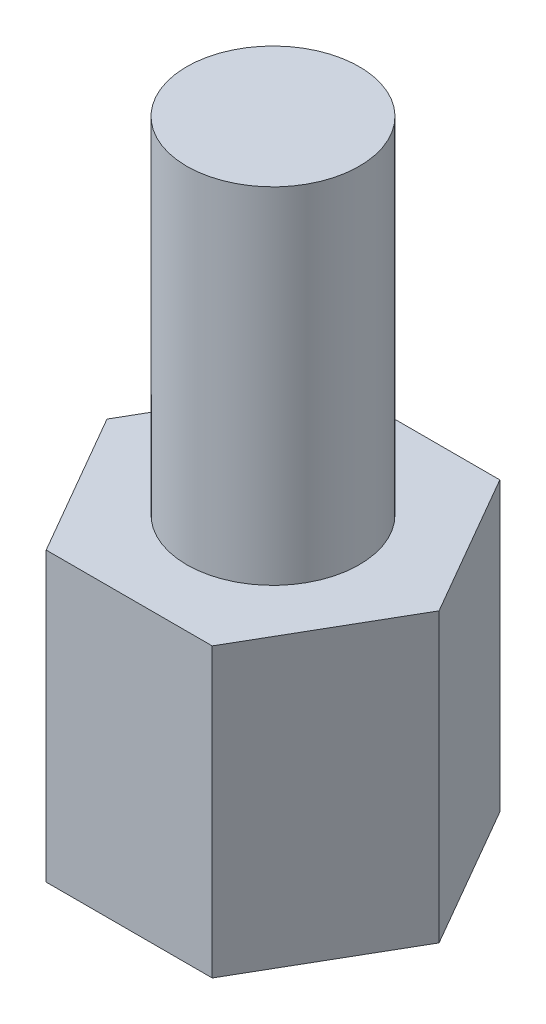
SolidWorks part; units mm, degrees
ref_plane "前视基准面" through (0, 0, 0) normal (0, 0, 1) x (1, 0, 0)
ref_plane "上视基准面" through (0, 0, 0) normal (0, 1, 0) x (1, 0, 0)
ref_plane "右视基准面" through (0, 0, 0) normal (1, 0, 0) x (0, 0, -1)
sketch "草图1" plane through (0, 0, 0) normal (0, 1, 0) x (1, 0, 0)
  line L1 (2.8868, 0) -> (1.4434, 2.5)
  line L2 (1.4434, 2.5) -> (-1.4434, 2.5)
  line L3 (-1.4434, 2.5) -> (-2.8868, 0)
  line L4 (-2.8868, 0) -> (-1.4434, -2.5)
  line L5 (-1.4434, -2.5) -> (1.4434, -2.5)
  line L6 (1.4434, -2.5) -> (2.8868, 0)
  circle A0 centre (0, 0) radius 2.5 construction
  circle A1 centre (0, 0) radius 1.5
  dimension "D1" = 3
  dimension "D2" = 5
extrude "凸台-拉伸1" add sketch "草图1" along normal blind 5
sketch "草图2" plane through (0, 5, 0) normal (0, 1, 0) x (1, 0, 0)
  circle A0 centre (0, 0) radius 1.5 construction
  circle A1 centre (0, 0) radius 1.5
extrude "凸台-拉伸2" add sketch "草图2" along normal blind 6 separate body
